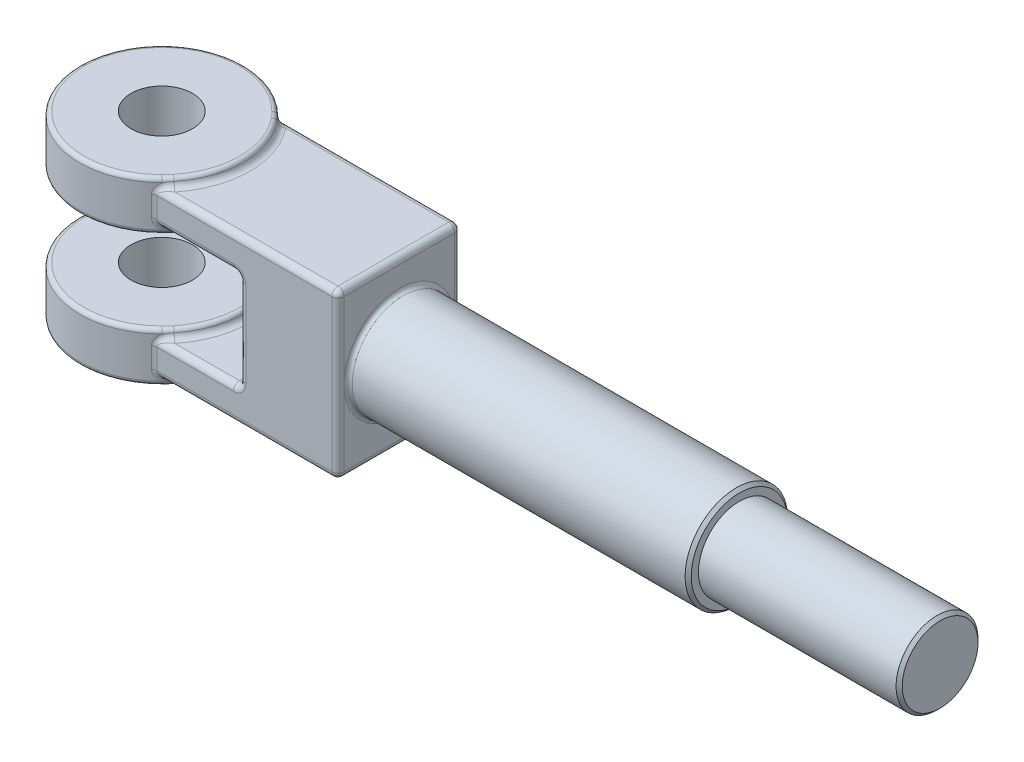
SolidWorks part; units mm, degrees
ref_plane "Plane1" through (0, 0, 0) normal (0, 0, 1) x (1, 0, 0)
ref_plane "Plane2" through (0, 0, 0) normal (0, 1, 0) x (1, 0, 0)
ref_plane "Plane3" through (0, 0, 0) normal (1, 0, 0) x (0, 0, -1)
sketch "Esquisse1" plane through (0, 0, 0) normal (0, 0, 1) x (1, 0, 0)
  line L0 (-98, 40) -> (-3, 40)
  line L1 (-98, 40) -> (-98, 24)
  line L2 (-3, -40) -> (-98, -40)
  line L3 (0, -37) -> (0, 37)
  line L4 (-98, 24) -> (-51, 24)
  line L5 (-48, 21) -> (-48, -21)
  line L6 (-51, -24) -> (-98, -24)
  line L7 (-98, -24) -> (-98, -40)
  arc A0 (0, 37) -> (-3, 40) centre (-3, 37) ccw
  arc A1 (0, -37) -> (-3, -40) centre (-3, -37) cw
  arc A2 (-48, 21) -> (-51, 24) centre (-51, 21) ccw
  arc A3 (-48, -21) -> (-51, -24) centre (-51, -21) cw
  point P11 (0, 40)
  point P14 (0, -40)
  point P17 (-48, 24)
  point P20 (-48, -24)
  dimension "D6" = 3
  dimension "D1" = 48
  dimension "D2" = 80
  dimension "D3" = 48
  dimension "D4" = 50
  dimension "D5" = 16
  dimension "D7" = 24
  dimension "D8" = 48
extrude "Base-Extrusion" add sketch "Esquisse1" along normal mid plane 60
sketch "Esquisse3" plane through (0, 0, 0) normal (1, 0, 0) x (0, 0, -1)
  circle A0 centre (0, 0) radius 25
  dimension "D1" = 50
extrude "Boss.-Extru.1" add sketch "Esquisse3" along normal blind 166
sketch "Esquisse4" plane through (166, 0, 0) normal (1, 0, 0) x (0, 0, -1)
  circle A0 centre (0, 0) radius 20
  dimension "D1" = 40
extrude "Boss.-Extru.2" add sketch "Esquisse4" along normal blind 98
sketch "Esquisse5" plane through (0, 0, 0) normal (0, 1, 0) x (1, 0, 0)
  line L0 (166, 0) -> (0, 0) construction
  circle A0 centre (-116, 0) radius 40
  dimension "D1" = 80
  dimension "D2" = 116
extrude "Boss.-Extru.3" add sketch "Esquisse5" along normal mid plane 88
sketch "Esquisse6" plane through (0, 44, 0) normal (0, 1, 0) x (-1, 0, 0)
  circle A0 centre (116, 0) radius 15
  circle A1 centre (116, 0) radius 40 construction
  dimension "D1" = 30
extrude "Enlèv. mat.-Extru.1" cut sketch "Esquisse6" against normal through all
sketch "Esquisse8" plane through (0, 0, 0) normal (0, 0, 1) x (1, 0, 0)
  line L0 (-163.2753, 0) -> (-68.0591, 0)
  line L1 (166, 0) -> (0, 0) construction
extrude "Enlèv. de mat.-Extru.-Mince1" cut sketch "Esquisse8" against normal through all thin
sketch "Esquisse9" plane through (0, 0, 0) normal (0, 1, 0) x (1, 0, 0)
  line L0 (166, 0) -> (0, 0) construction
  circle A0 centre (-116, 0) radius 40
  dimension "D2" = 80
  dimension "D1" = 116
extrude "Boss.-Extru.4" add sketch "Esquisse9" along normal mid plane 88
sketch "Esquisse10" plane through (0, 0, 0) normal (0, 0, 1) x (1, 0, 0)
  line L0 (-166.3141, 0) -> (-64.0073, 0)
extrude "Enlèv. de mat.-Extru.-Mince2" cut sketch "Esquisse10" against normal mid plane 88 thin
fillet "Congé2" radius 3
fillet "Congé3" radius 2
fillet "Congé4" radius 2
chamfer "Chanfrein1" distance 1.5 angle 45
sketch "Esquisse11" plane through (0, -44, 0) normal (0, -1, 0) x (1, 0, 0)
  circle A0 centre (-116, 0) radius 15
  dimension "D1" = 30
extrude "Enlèv. mat.-Extru.2" cut sketch "Esquisse11" against normal through all
